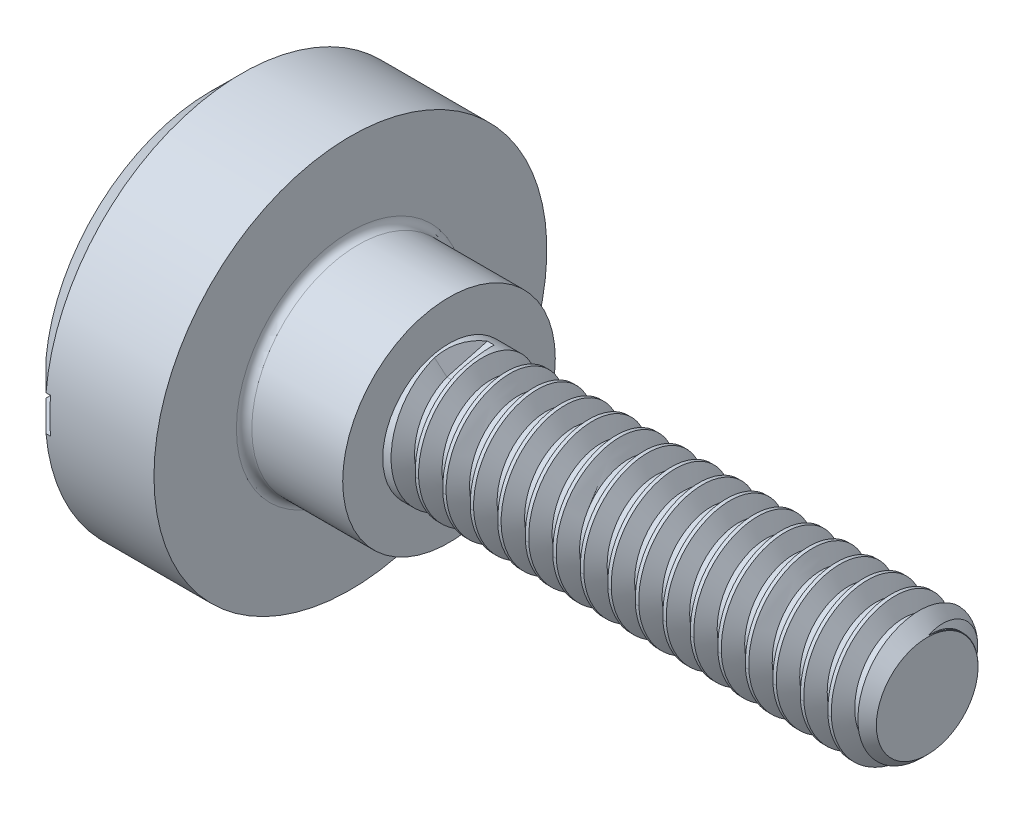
SolidWorks part; units mm, degrees
ref_plane "Front Plane" through (0, 0, 0) normal (0, 0, 1) x (1, 0, 0)
ref_plane "Top Plane" through (0, 0, 0) normal (0, 1, 0) x (1, 0, 0)
ref_plane "Right Plane" through (0, 0, 0) normal (1, 0, 0) x (0, 0, -1)
sketch "Sketch1" plane through (0, 0, 0) normal (0, 0, 1) x (1, 0, 0)
  line L0 (0, 0) -> (18.4859, 0) construction
  line L1 (0, 0) -> (0, 13.327) construction
  line L2 (0, 0) -> (11.811, 0)
  line L3 (11.811, 0) -> (11.811, 0.8382)
  line L4 (11.557, 1.0922) -> (3.9268, 1.0922)
  line L5 (3.9268, 1.0922) -> (3.9268, 1.7526)
  line L6 (3.9268, 1.7526) -> (2.4282, 1.7526)
  line L7 (2.3012, 1.8796) -> (2.3012, 3.2385)
  line L8 (2.3012, 3.2385) -> (0.508, 3.2385)
  line L9 (0, 2.7305) -> (0, 0)
  line L10 (0.508, 3.2385) -> (0, 2.7305)
  line L11 (11.811, 0.8382) -> (11.557, 1.0922)
  arc A0 (2.4282, 1.7526) -> (2.3012, 1.8796) centre (2.4282, 1.8796) cw
  point P6 (11.811, 1.0922)
  point P11 (0, 3.2385)
  point P17 (2.3012, 1.7526)
  dimension "D7" = 0.127
  dimension "D1" = 6.477
  dimension "D2" = 3.5052
  dimension "D3" = 2.1844
  dimension "D4" = 11.811
  dimension "D5" = 3.9268
  dimension "D6" = 1.6256
revolve "Revolve1" add sketch "Sketch1" angle 360 about L2
thread "Thread1" pitch 0.4536 start angle 0, offset 1.524, length 8.7122, pitch 0.4536, diameter 2.1844
ref_plane "Plane1" through (13.081, 0, 1.0922) normal (0, -1, 0) x (0, 0, 1)
sketch "Thread Profile1" plane through (13.081, 0, 1.0922) normal (0, -1, 0) x (0, 0, 1)
  line L0 (0, 0) -> (0, 0.4536) construction
  line L11 (0, 0) -> (0, 0.3969)
  line L12 (0, 0.3969) -> (-0.2455, 0.2551)
  line L13 (-0.2455, 0.2551) -> (-0.2455, 0.1417)
  line L15 (-0.2455, 0.1417) -> (0, 0)
  line L17 (-0.2455, 0.1984) -> (0, 0.1984) construction
  point P2 (0, 0)
  dimension "Pitch" = 0.4536
  dimension "Profile_Angle" = 60
  dimension "Profile_Land" = 0.1134
  dimension "Profile_Height" = 0.2455
sketch "Sketch2" plane through (0, 0, 0) normal (-1, 0, 0) x (0, 0, 1)
  line L1 (-3.81, -0.2921) -> (3.81, -0.2921)
  line L2 (-3.81, -0.2921) -> (-3.81, 0.2921)
  line L3 (-3.81, 0.2921) -> (3.81, 0.2921)
  line L4 (3.81, -0.2921) -> (3.81, 0.2921)
  line L5 (-3.81, -0.2921) -> (3.81, 0.2921) construction
  line L6 (-3.81, 0.2921) -> (3.81, -0.2921) construction
  point P0 (0, 0)
  dimension "D1" = 0.5842
  dimension "D2" = 7.62
extrude "Cut-Extrude1" cut sketch "Sketch2" against normal blind 0.5842
sketch "Sketch3" plane through (0, -0.0002, 0.0009) normal (0.0002, -0.2609, 0.9654) x (1, 0.0001, -0.0002)
  line L4 (4.2277, 0.8467) -> (4.3695, 1.0922)
  line L5 (4.3695, 1.0922) -> (3.9726, 1.0922)
  line L6 (3.9726, 1.0922) -> (4.1143, 0.8467)
  line L7 (4.1143, 0.8467) -> (4.2277, 0.8467)
  line L8 (4.2277, 0.8467) -> (4.3695, 1.0922)
  line L9 (4.3695, 1.0922) -> (3.9726, 1.0922)
  line L10 (3.9726, 1.0922) -> (4.1143, 0.8467)
  line L11 (4.1143, 0.8467) -> (4.2277, 0.8467)
  dimension "D1" = 0
extrude "Cut-Extrude2" cut sketch "Sketch3" against normal up to surface (0.0004 mm away)
